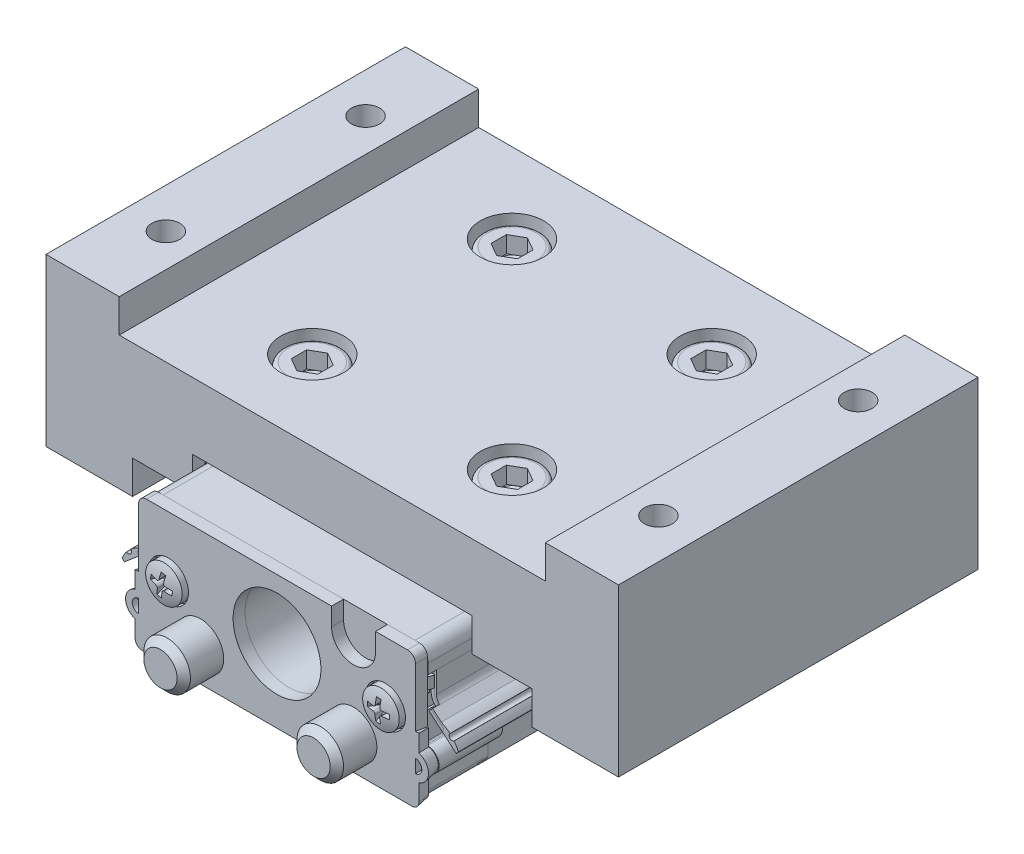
SolidWorks part; units mm, degrees
other "KKR60-FS-P_W-1-solid16"
other "KKR60-FS-P_W-1-solid17"
other "KKR60-FS-P_W-1-solid4"
other "GB∕T70.1-M5×10（内六角圆柱头螺钉）-2-solid1"
other "KKR60-FS-P_W-1-solid15"
other "KKR60-FS-P_W-1-solid11"
other "KKR60-FS-P_W-1-solid12"
other "KKR60-FS-P_W-1-solid3"
other "KKR60-FS-P_W-1-solid14"
other "KKR60-FS-P_W-1-solid18"
other "KKR60-FS-P_W-1-solid10"
other "GB∕T70.1-M5×10（内六角圆柱头螺钉）-3-solid1"
other "KKR60-FS-P_W-1-solid7"
other "KKR60-FS-P_W-1-solid6"
other "KKR60-FS-P_W-1-solid9"
other "KKR60-FS-P_W-1-solid5"
other "KKR60-FS-P_W-1-solid8"
other "KKR60-FS-P_W-1-solid13"
other "KKR60-FS-P_W-1-solid19"
other "GB∕T70.1-M5×10（内六角圆柱头螺钉）-1-solid1"
other "GB∕T70.1-M5×10（内六角圆柱头螺钉）-4-solid1"
other "KKR60-FS-P_W-1-solid1"
ref_plane "前视基准面" through (0, 0, 0) normal (0, 0, 1) x (1, 0, 0)
ref_plane "上视基准面" through (0, 0, 0) normal (0, 1, 0) x (1, 0, 0)
ref_plane "右视基准面" through (0, 0, 0) normal (1, 0, 0) x (0, 0, -1)
imported_body "输入1"
imported_body "输入2"
imported_body "输入3"
imported_body "输入5"
imported_body "输入7"
imported_body "输入8"
imported_body "输入9"
imported_body "输入10"
imported_body "输入11"
imported_body "输入12"
imported_body "输入13"
imported_body "输入14"
imported_body "输入15"
imported_body "输入18"
imported_body "输入19"
imported_body "输入20"
imported_body "输入21"
imported_body "输入22"
imported_body "输入23"
imported_body "输入24"
imported_body "输入25"
imported_body "输入26"
imported_body "输入27"
sketch "草图1" plane through (0, 0, 70.2) normal (0, 0, -1) x (-1, 0, 0)
  circle A0 centre (0, 23) radius 6.6 construction
  circle A1 centre (0, 23) radius 6.6
extrude "切除-拉伸2" cut sketch "草图1" against normal through all
sketch "草图2" plane through (-20.9, 0, 0) normal (-1, 0, 0) x (0, 0, 1)
  line L0 (70.2, 28.5) -> (79.7, 28.5) construction
  line L1 (72.3273, 28.5) -> (76.3273, 28.5)
  line L2 (72.3273, 28.5) -> (72.3273, 30)
  line L3 (72.3273, 30) -> (76.3273, 30)
  line L4 (76.3273, 28.5) -> (76.3273, 30)
  line L5 (70.2, 30) -> (79.7, 30) construction
extrude "切除-拉伸3" cut sketch "草图2" along normal blind 10
sketch "草图3" plane through (20.9, 0, 0) normal (1, 0, 0) x (0, 0, -1)
  line L0 (-137.2, 30) -> (-127.7, 30) construction
  line L1 (-135.1431, 30) -> (-131.1536, 30)
  line L2 (-135.1431, 30) -> (-135.1431, 28.5)
  line L3 (-135.1431, 28.5) -> (-131.1536, 28.5)
  line L4 (-131.1536, 30) -> (-131.1536, 28.5)
  line L5 (-137.2, 28.5) -> (-127.7, 28.5) construction
extrude "切除-拉伸4" cut sketch "草图3" along normal blind 10
